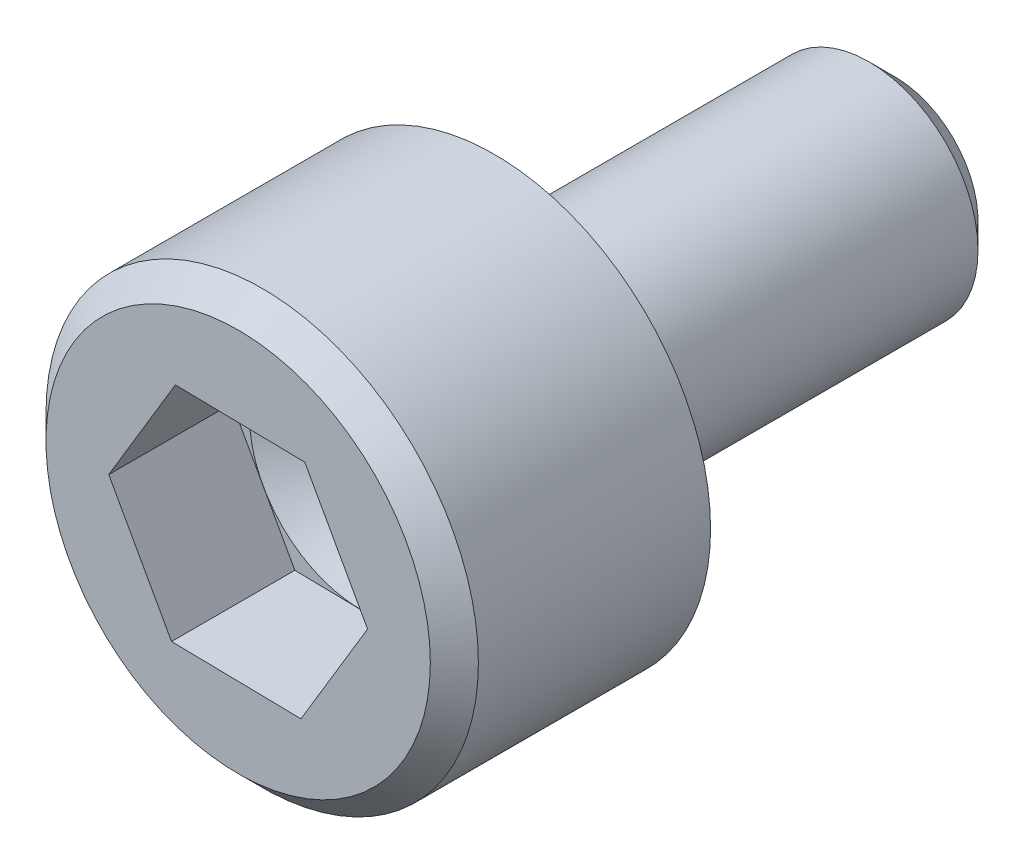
SolidWorks part; units mm, degrees
ref_plane "Front Plane" through (0, 0, 0) normal (0, 0, 1) x (1, 0, 0)
ref_plane "Top Plane" through (0, 0, 0) normal (0, 1, 0) x (1, 0, 0)
ref_plane "Right Plane" through (0, 0, 0) normal (1, 0, 0) x (0, 0, -1)
sketch "Sketch1" plane through (0, 0, 0) normal (0, 0, 1) x (1, 0, 0)
  circle A0 centre (0, 0) radius 3.429
  dimension "D1" = 6.858
extrude "Boss-Extrude1" add sketch "Sketch1" against normal blind 4.064
sketch "Sketch2" plane through (0, 0, -4.064) normal (0, 0, -1) x (-1, 0, 0)
  circle A0 centre (0, 0) radius 1.7272
  dimension "D1" = 3.4544
extrude "Boss-Extrude2" add sketch "Sketch2" along normal blind 6.35
chamfer "Chamfer1" distance 0.381 angle 45 1 edges at (3.429, 0, 0)
chamfer "Chamfer2" distance 0.4064 angle 45 1 edges at (-1.7272, 0, -10.414)
sketch "Sketch3" plane through (0, 0, 0) normal (0, 0, 1) x (1, 0, 0)
  line L1 (1.0567, 1.7602) -> (-0.996, 1.7953)
  line L2 (-0.996, 1.7953) -> (-2.0528, 0.035)
  line L3 (-2.0528, 0.035) -> (-1.0567, -1.7602)
  line L4 (-1.0567, -1.7602) -> (0.996, -1.7953)
  line L5 (0.996, -1.7953) -> (2.0528, -0.035)
  line L6 (2.0528, -0.035) -> (1.0567, 1.7602)
  circle A0 centre (0, 0) radius 1.778 construction
  dimension "D1" = 3.556
extrude "Cut-Extrude1" cut sketch "Sketch3" against normal blind 1.9558
sketch "Sketch4" plane through (0, 0, 0) normal (1, 0, 0) x (0, 0, -1)
  line L0 (1.9558, 1.7777) -> (2.9718, 0)
  line L1 (1.9558, 1.7602) -> (1.9558, 1.7953) construction
  line L2 (2.9718, 0) -> (1.9558, 0)
  line L3 (1.9558, 0.035) -> (1.9558, -1.7602) construction
  line L4 (1.9558, 0) -> (1.9558, 1.7777)
  dimension "D1" = 1.016
revolve "Cut-Revolve1" cut sketch "Sketch4" angle 360 about L2
